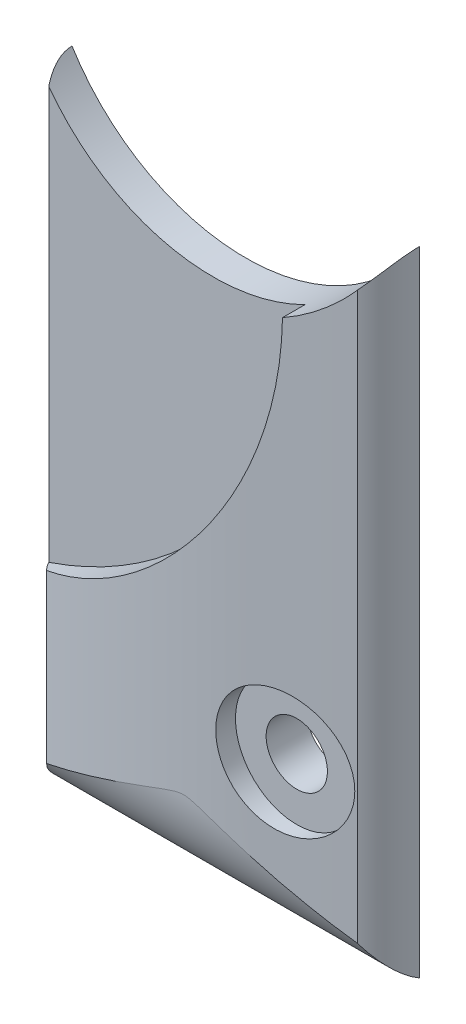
SolidWorks part; units mm, degrees
ref_plane "Plan1" through (0, 0, 0) normal (0, 0, 1) x (1, 0, 0)
ref_plane "Plan2" through (0, 0, 0) normal (0, 1, 0) x (1, 0, 0)
ref_plane "Plan3" through (0, 0, 0) normal (1, 0, 0) x (0, 0, -1)
sketch "Esquisse1" plane through (0, 0, 0) normal (0, 0, 1) x (1, 0, 0)
  line L0 (-29, -11) -> (-29, -42)
  line L1 (-29, -42) -> (-12, -42)
  line L2 (-12, -42) -> (-12, -11)
  arc A0 (-29, -11) -> (-12, -11) centre (-20.5, -5.7322) ccw
  circle A1 centre (-16, -33.5) radius 1.5
  dimension "D4" = 10
  dimension "D5" = 3
  dimension "D1" = 17
  dimension "D2" = 31
  dimension "D3" = 31
  dimension "D6" = 8.5
  dimension "D7" = 4
extrude "Base-Extrusion" add sketch "Esquisse1" along normal blind 3
sketch "Esquisse2" plane through (0, 0, 3) normal (0, 0, 1) x (1, 0, 0)
  circle A0 centre (-16, -33.5) radius 3
  dimension "D1" = 6
extrude "Enlèv. mat.-Extru.1" cut sketch "Esquisse2" against normal blind 1
fillet "Congé1" radius 3 6 edges at (-12, -26.5, 3) (-29, -26.5, 3) (-12, -11, 1.5) (-12, -42, 1.5) (-29, -42, 1.5) (-29, -11, 1.5)
sketch "Esquisse4" plane through (0, -42, 0) normal (0, -1, 0) x (1, 0, 0)
  line L0 (-26, 3) -> (-15, 3) construction
  line L1 (-28.0834, 2.1585) -> (-28, 5)
  line L2 (-28, 5) -> (-12.8938, 4.5564)
  line L3 (-12.8938, 4.5564) -> (-12.8938, 2.1363)
  arc A0 (-12.8938, 2.1363) -> (-28.0834, 2.1585) centre (-20.5374, -31.2561) ccw
  arc A1 (-12, 0) -> (-15, 3) centre (-15, 0) ccw construction
  arc A2 (-26, 3) -> (-29, 0) centre (-26, 0) ccw construction
extrude "Enlèv. mat.-Extru.2" cut sketch "Esquisse4" against normal through all
ref_plane "Plan4" through (0, 0, 3.1) normal (0, 0, 1) x (1, 0, 0)
sketch "Esquisse6" plane through (0, 0, 3.1) normal (0, 0, 1) x (1, 0, 0)
  line L0 (-29, -11) -> (-29, -42) construction
  line L2 (-16, -14.6625) -> (-31, -9)
  line L3 (-31, -9) -> (-32, -33)
  line L4 (-32, -33) -> (-29, -32)
  arc A1 (-28.0834, -12.2507) -> (-12.8938, -12.2242) centre (-20.5, -5.7322) ccw construction
  arc A2 (-16, -14.6625) -> (-29, -32) centre (-34.4378, -14.38) cw
  dimension "D4" = 18.44
extrude "Enlèv. mat.-Extru.3" cut sketch "Esquisse6" against normal blind 1.5
sketch "Esquisse7" plane through (0, 0, 0) normal (1, 0, 0) x (0, 0, -1)
  line L0 (0, -42) -> (-0.3134, -42.5437)
  line L1 (-0.3134, -42.5437) -> (-3.6362, -42.5437)
  line L2 (-3.6362, -42.5437) -> (-3.6362, -37)
  line L3 (-3.6362, -37) -> (-3, -37)
  arc A0 (0, -42) -> (-3, -37) centre (2.9967, -36.802) cw
extrude "Enlèv. mat.-Extru.4" cut sketch "Esquisse7" against normal through all
